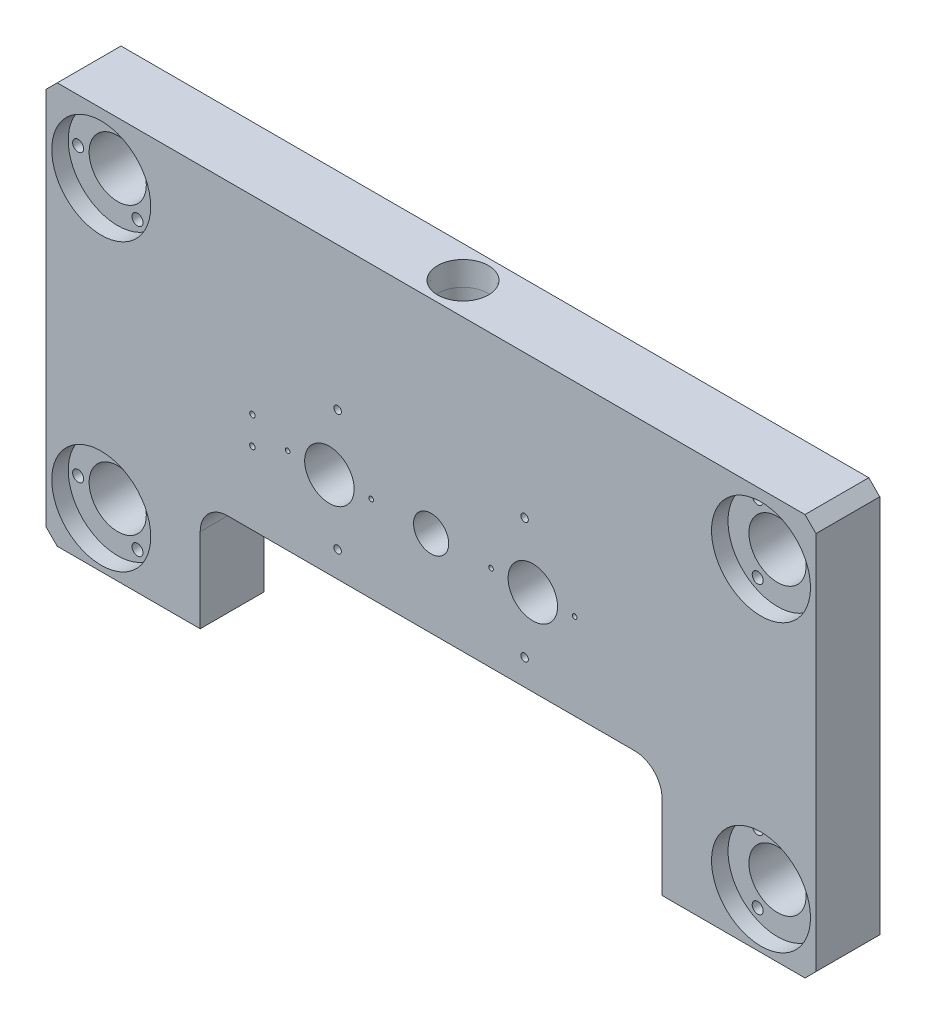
SolidWorks part; units mm, degrees
ref_plane "Frontal" through (0, 0, 0) normal (0, 0, 1) x (1, 0, 0)
ref_plane "Horizontal" through (0, 0, 0) normal (0, 1, 0) x (1, 0, 0)
ref_plane "Vertical" through (0, 0, 0) normal (1, 0, 0) x (0, 0, -1)
imported_body "Importée1"
sketch "Esquisse1" plane through (0, 0, 58) normal (0, 0, 1) x (1, 0, 0)
  circle A0 centre (92.5, 0) radius 22.5
  circle A1 centre (-92.5, 0) radius 22.5
  dimension "D1" = 45
  dimension "D2" = 45
extrude "Extrusion1" cut sketch "Esquisse1" against normal through all
hole_wizard "Trou taraudé M51" positions "Esquisse5" profile "Esquisse4" tap size "M5" standard "ISO"
sketch "Esquisse5" plane through (0, 0, 58) normal (0, 0, 1) x (1, 0, 0)
  line L0 (60.3527, 0) -> (131.5539, 0) construction
  line L1 (92.5, 22.5) -> (92.5, -22.5) construction
  line L2 (0, -114.2472) -> (0, 41.5004) construction
  circle A0 centre (92.5, 0) radius 22.5 construction
  point P0 (130.5, 0)
  point P11 (54.5, 0)
  point P14 (-130.5, 0)
  point P15 (-54.5, 0)
  dimension "D1" = 76
sketch "Esquisse4" plane through (130.5, 0, 58) normal (1, 0, 0) x (0, -1, 0)
  line L0 (0, 0) -> (0, 25.2618)
  line L1 (0, 25.2618) -> (2.1, 24)
  line L2 (2.1, 24) -> (2.1, 0)
  line L5 (2.1, 0) -> (0, 0)
  line L10 (0, 25.2618) -> (-2.1, 24) construction
  line L11 (0, -6.35) -> (0, 107.95) construction
  dimension "Diamètre du trou pour taraudage" = 4.2
  dimension "Profondeur du trou pour taraudage" = 24
  dimension "Angle de pointe" = 118
other "SupprimerFace1"
other "SupprimerFace2"
other "SupprimerFace3"
other "SupprimerFace4"
other "SupprimerFace5"
sketch "Esquisse6" plane through (0, 0, 58) normal (0, 0, 1) x (1, 0, 0)
  line L0 (-92.5, 0) -> (92.5, 0) construction
  circle A0 centre (0, 0) radius 16
  dimension "D1" = 32
extrude "Extrusion2" cut sketch "Esquisse6" against normal through all
sketch "Esquisse7" plane through (0, 0, 58) normal (0, 0, 1) x (1, 0, 0)
  point P0 (-162.5, -12.5)
ref_plane "Plan1" through (-162.5, 0, 0) normal (-1, 0, 0) x (0, 0, 1)
